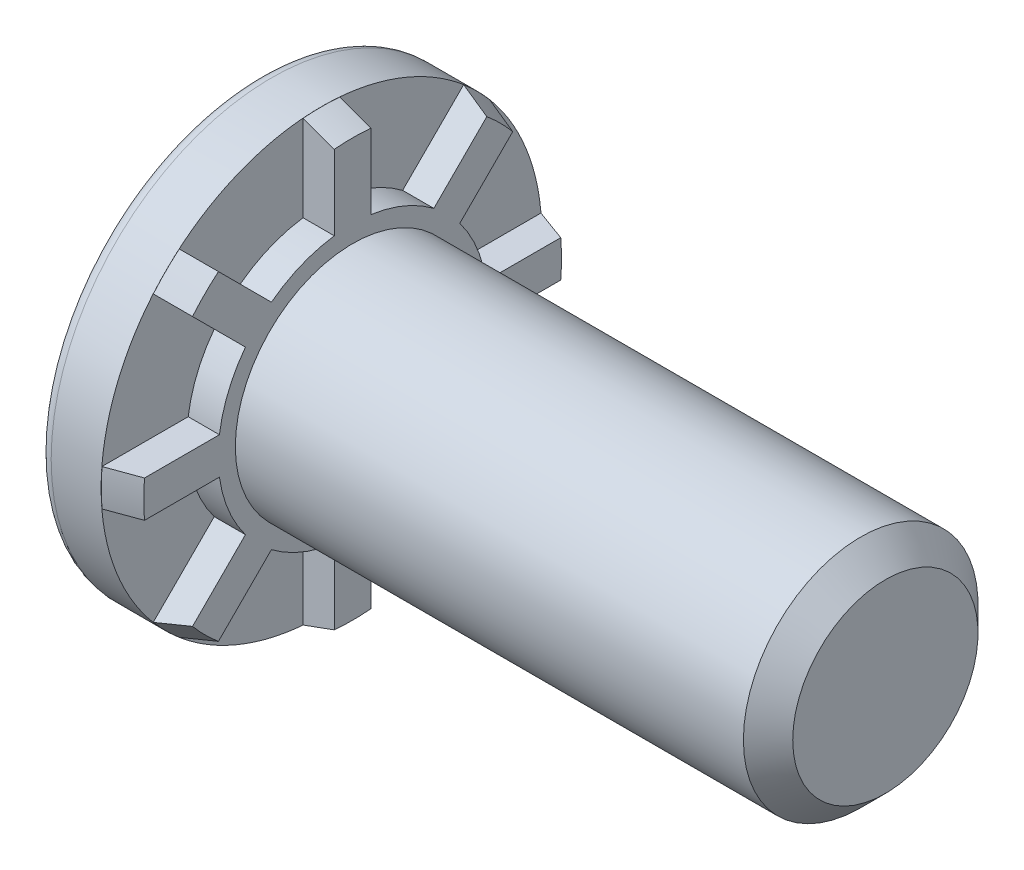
SolidWorks part; units mm, degrees
ref_plane "Plane1" through (0, 0, 0) normal (0, 0, 1) x (1, 0, 0)
ref_plane "Plane2" through (0, 0, 0) normal (0, 1, 0) x (1, 0, 0)
ref_plane "Plane3" through (0, 0, 0) normal (1, 0, 0) x (0, 0, -1)
sketch "BodySke" plane through (0, 0, 0) normal (0, 0, 1) x (1, 0, 0)
  line L0 (-2.1082, 7.0206) -> (-2.1082, 0)
  line L1 (1.0541, 7.0569) -> (1.0541, 3.9624)
  line L2 (0.0025, 7.4397) -> (1.0541, 7.0569)
  line L3 (1.0541, 3.9624) -> (18.2169, 3.9624)
  line L4 (19.05, 3.1293) -> (19.05, 0)
  line L5 (19.05, 0) -> (-2.1082, 0)
  line L6 (0, 0) -> (50.554, 0) construction
  line L8 (19.05, 3.1293) -> (18.2169, 3.9624)
  line L9 (-1.6866, 7.4422) -> (0, 7.4422)
  line L10 (0.0025, 7.4397) -> (0, 7.4397)
  line L11 (1.4097, 19.05) -> (1.4097, -3.175) construction
  line L12 (0, 7.4397) -> (0, 7.4422)
  arc A0 (-2.1082, 7.0206) -> (-1.6866, 7.4422) centre (-1.6866, 7.0206) cw
  dimension "D2" = 0.0025
  dimension "Fillet_rad" = 0.4216
  dimension "D1" = 20
  dimension "Diameter" = 7.9248
  dimension "D3" = 0.0025
  dimension "Length" = 19.05
  dimension "Body_ch_ang" = 45
  dimension "Minor_dia" = 6.2586
  dimension "Advance" = 1.4097
  dimension "H_dia" = 14.8844
  dimension "T_dim" = 2.1082
  dimension "Clinch_ht" = 1.0541
revolve "BaseBody" add sketch "BodySke" angle 360 about L6
sketch "ThdSchSke" plane through (0, 0, 0) normal (0, 0, 1) x (1, 0, 0)
  line L0 (3.3782, -3.1293) -> (2.7948, -3.9624)
  line L1 (3.3782, -3.1293) -> (3.9616, -3.9624)
  line L2 (3.9616, -3.9624) -> (3.9616, -4.953)
  line L3 (-3.175, 0) -> (5.1513, 0) construction
  line L4 (0, -7.4422) -> (0, 7.4422) construction
  line L5 (3.9616, -4.953) -> (2.7948, -4.953)
  line L6 (2.7948, -4.953) -> (2.7948, -3.9624)
  dimension "Thread_minor" = 6.2586
  dimension "Diameter" = 7.9248
  dimension "Start" = 3.3782
  dimension "SideAngle" = 55
  dimension "VeeAngle" = 70
  dimension "Overcut" = 9.906
revolve "ThreadSchematic" [suppressed] cut sketch "ThdSchSke" angle 360 about L3
pattern_linear "ThdSchPat" [suppressed]
sketch "RibCutSke" plane through (1.0541, 1.7944, -0.091) normal (1, 0, 0) x (0, 0, -1)
  line L0 (0.5289, 2.7055) -> (0.5289, 5.6219)
  line L1 (2.6526, 1.8258) -> (4.7149, 3.888)
  line L2 (0.5289, 2.1192) -> (0.5289, 2.4006) construction
  line L3 (-0.091, -1.7944) -> (-0.091, 5.0239) construction
  line L4 (-0.091, -1.7944) -> (0.5289, 2.1192) construction
  line L5 (-0.091, -1.7944) -> (2.2381, 1.4112) construction
  line L6 (2.2381, 1.4112) -> (2.4421, 1.6153) construction
  arc A1 (2.6526, 1.8258) -> (0.5289, 2.7055) centre (-0.091, -1.7944) ccw
  arc A2 (4.7149, 3.888) -> (0.5289, 5.6219) centre (-0.091, -1.7944) ccw
  circle A3 centre (-0.091, -1.7944) radius 7.0569 construction
  circle A4 centre (-0.091, -1.7944) radius 3.9624 construction
  dimension "Inner_dia" = 9.0847
  dimension "Outer_dia" = 14.8844
  dimension "Rib_root_dia" = 7.9248
  dimension "Rib_root_half_angle" = 9
  dimension "Rib_root_gap_angle" = 27
  dimension "Angle" = 45
extrude "RibCut" cut sketch "RibCutSke" against normal blind 1.0541
pattern_circular "RibCutsPat" count 8 every 45 about axis through (0, 0, 0) along (1, 0, 0) of "RibCut"
equation "' \"Length@BodySke\" = 0.75"
equation "' \"H_dia@BodySke\" = 0.586"
equation "' \"Start@ThdSchSke\" = 0.133"
equation "' \"T_dim@BodySke\" = 0.083"
equation "' \"Diameter@BodySke\" = 0.312"
equation "' \"Minor_dia@BodySke\" = 0.2464"
equation "' \"Advance@BodySke\" = 0.0555"
equation "\"Fillet_rad@BodySke\" =  \"T_dim@BodySke\" * 0.2"
equation "\"Clinch_ht@BodySke\" = \"T_dim@BodySke\" * 0.5"
equation "\"Num_ribs@RibCutsPat\" = 8"
equation "\"Angle@RibCutSke\" =\"Angle@RibCutsPat\""
equation "\"Rib_root_half_angle@RibCutSke\" = \"Angle@RibCutSke\" / 5"
equation "\"Rib_root_gap_angle@RibCutSke\" = \"Angle@RibCutSke\" - (2 * \"Rib_root_half_angle@RibCutSke\" )"
equation "\"Rib_root_dia@RibCutSke\" = \"Diameter@BodySke\""
equation "\"Inner_dia@RibCutSke\" = \"Diameter@BodySke\" + ( \"H_dia@BodySke\" - \"Diameter@BodySke\" ) / 6"
equation "\"Outer_dia@RibCutSke\" = \"H_dia@BodySke\""
equation "\"Depth@RibCut\" = \"Clinch_ht@BodySke\""
equation "\"Thread_length@ThreadCosmetic\" = \"Length@BodySke\" - \"Start@ThdSchSke\""
equation "\"Thread_minor@ThreadCosmetic\" = \"Minor_dia@BodySke\""
equation "\"Thread_minor@ThdSchSke\" = \"Minor_dia@BodySke\""
equation "\"Diameter@ThdSchSke\" = \"Diameter@BodySke\""
equation "\"Overcut@ThdSchSke\" = \"Diameter@BodySke\" * 1.25"
equation "\"Num_threads@ThdSchPat\" = int( \"Thread_length@ThreadCosmetic\" / \"Advance@BodySke\" + 0.999 )  + 1"
equation "\"Advance@ThdSchPat\" = \"Thread_length@ThreadCosmetic\" /  (\"Num_threads@ThdSchPat\" - 1) 'relax it"
equation "\"Num_threads@ThdSchPat\" = \"Num_threads@ThdSchPat\" - sgn( \"Num_threads@ThdSchPat\" - 1) '---chamfered tips only---"
